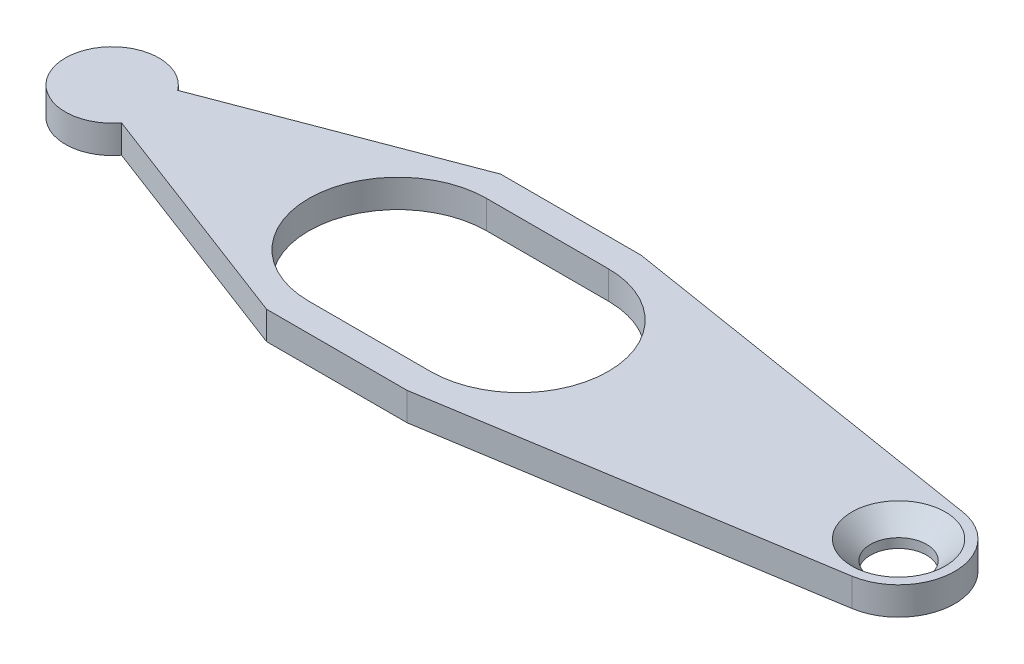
SolidWorks part; units mm, degrees
ref_plane "Front Plane" through (0, 0, 0) normal (0, 0, 1) x (1, 0, 0)
ref_plane "Top Plane" through (0, 0, 0) normal (0, 1, 0) x (1, 0, 0)
ref_plane "Right Plane" through (0, 0, 0) normal (1, 0, 0) x (0, 0, -1)
sketch "Sketch1" plane through (0, 0, 0) normal (0, 1, 0) x (1, 0, 0)
  line L0 (0, 0) -> (84, 0) construction
  line L1 (30.5, 9.5) -> (43.5, 9.5)
  line L2 (43.5, -9.5) -> (30.5, -9.5)
  line L3 (4, 3) -> (29, 12.5)
  line L4 (4, -3) -> (29, -12.5)
  line L5 (29, -12.5) -> (44, -12.5)
  line L6 (44, -12.5) -> (84.9513, -5.9241)
  line L7 (29, 12.5) -> (44, 12.5)
  line L8 (44, 12.5) -> (84.9513, 5.9241)
  arc A0 (4, 3) -> (4, -3) centre (0, 0) ccw
  arc A1 (30.5, 9.5) -> (30.5, -9.5) centre (30.5, 0) ccw
  arc A2 (43.5, -9.5) -> (43.5, 9.5) centre (43.5, 0) ccw
  arc A3 (84.9513, -5.9241) -> (84.9513, 5.9241) centre (84, 0) ccw
  dimension "D1" = 5
  dimension "D4" = 9.5
  dimension "D5" = 30.5
  dimension "D6" = 13
  dimension "D7" = 40.5
  dimension "D8" = 6
  dimension "D11" = 29
  dimension "D12" = 29
  dimension "D15" = 40
  dimension "D2" = 3
  dimension "D3" = 6
  dimension "D9" = 15
  dimension "D10" = 15
  dimension "D13" = 12.5
  dimension "D14" = 12.5
extrude "Extrude1" add sketch "Sketch1" along normal blind 3
sketch "Sketch2" plane through (0, 3, 0) normal (0, 1, 0) x (1, 0, 0)
  point P0 (84, 0)
hole_wizard "CSK for M6 Countersunk Flat Head Screw1" positions "3DSketch1" profile "Sketch3" countersink size "M6" standard "ISO"
sketch3d "3DSketch1"
  point P0 (84, 3, 0)
sketch "Sketch3" plane through (84, 3, 0) normal (1, 0, 0) x (0, 0, 1)
  line L0 (0, 0) -> (0, 3)
  line L1 (0, 3) -> (3, 3)
  line L2 (3, 3) -> (3, 2)
  line L3 (3, 2) -> (5, 0)
  line L5 (5, 0) -> (0, 0)
  line L6 (-3, 2) -> (-5, 0) construction
  line L11 (0, -6.35) -> (0, 107.95) construction
  dimension "Thru Hole Dia." = 6
  dimension "Thru Hole Depth" = 3
  dimension "Near C'Sink Dia." = 10
  dimension "Near C'Sink Angle" = 90
